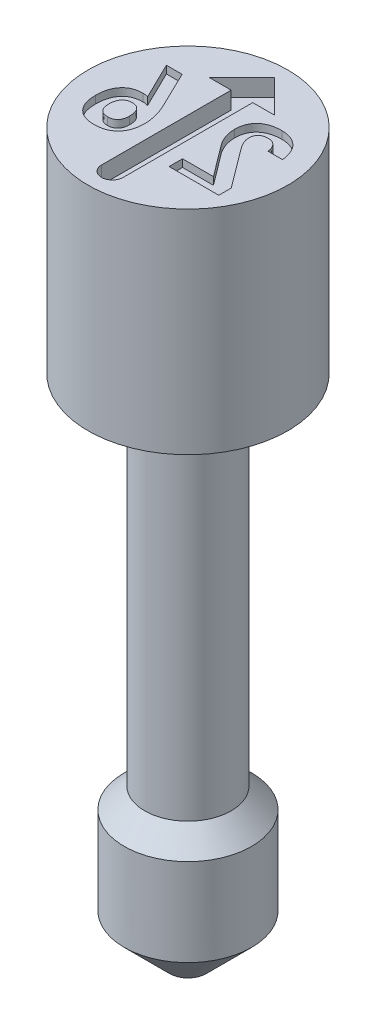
SolidWorks part; units mm, degrees
ref_plane "Front Plane" through (0, 0, 0) normal (0, 0, 1) x (1, 0, 0)
ref_plane "Top Plane" through (0, 0, 0) normal (0, 1, 0) x (1, 0, 0)
ref_plane "Right Plane" through (0, 0, 0) normal (1, 0, 0) x (0, 0, -1)
sketch "Sketch1" plane through (0, 0, 0) normal (0, 0, 1) x (1, 0, 0)
  line L0 (0, 17.018) -> (2.3495, 17.018)
  line L1 (0, -2.5845) -> (0, 2.5845) construction
  line L2 (2.3495, 17.018) -> (2.3495, 12.0142)
  line L3 (2.3495, 12.0142) -> (1.016, 12.0142)
  line L4 (1.016, 12.0142) -> (1.016, 3.6068)
  line L5 (1.016, 3.6068) -> (1.4986, 3.1242)
  line L6 (1.4986, 3.1242) -> (1.4986, 1.0668)
  line L7 (1.4986, 1.0668) -> (0.4318, 0)
  line L8 (2.5845, 0) -> (-2.5845, 0) construction
  line L9 (0.4318, 0) -> (0, 0)
  line L10 (0, 0) -> (0, 17.018)
  line L11 (0, 0) -> (0, 64.9194) construction
  dimension "D1" = 17.018
  dimension "D2" = 3.6068
  dimension "D3" = 1.0668
  dimension "D4" = 45
  dimension "D5" = 2.9972
  dimension "D6" = 4.699
  dimension "D7" = 2.032
  dimension "D8" = 5.0038
revolve "Revolve1" add sketch "Sketch1" angle 360 about L11
sketch "Sketch2" plane through (0, 17.018, 0) normal (0, 1, 0) x (1, 0, 0)
  line L1 (0.254, -1.778) -> (0.254, 1.27)
  line L2 (-0.254, -1.778) -> (-0.254, 1.27)
  line L3 (0, -2.5845) -> (0, 2.5845) construction
  line L4 (-0.254, 1.27) -> (-0.762, 1.27)
  line L5 (0.254, 1.27) -> (0.762, 1.27)
  line L6 (0.762, 1.27) -> (0, 2.032)
  line L7 (0, 2.032) -> (-0.762, 1.27)
  line L8 (-2.5845, 0) -> (2.5845, 0) construction
  arc A0 (-0.254, -1.778) -> (0.254, -1.778) centre (0, -1.778) ccw
  dimension "D6" = 1.778
  dimension "D1" = 0.508
  dimension "D2" = 0.254
  dimension "D3" = 1.524
  dimension "D4" = 0.762
  dimension "D5" = 45
  dimension "D7" = 1.27
extrude "Cut-Extrude1" cut sketch "Sketch2" against normal blind 0.4064
sketch "Sketch4" plane through (0, 17.018, 0) normal (0, 1, 0) x (1, 0, 0)
  text T0 "2 6" font "Bahnschrift SemiBold" height 2.032
  dimension "D1" = 1.016
  dimension "D2" = 1.905
extrude "Cut-Extrude2" cut sketch "Sketch4" against normal blind 0.1778
